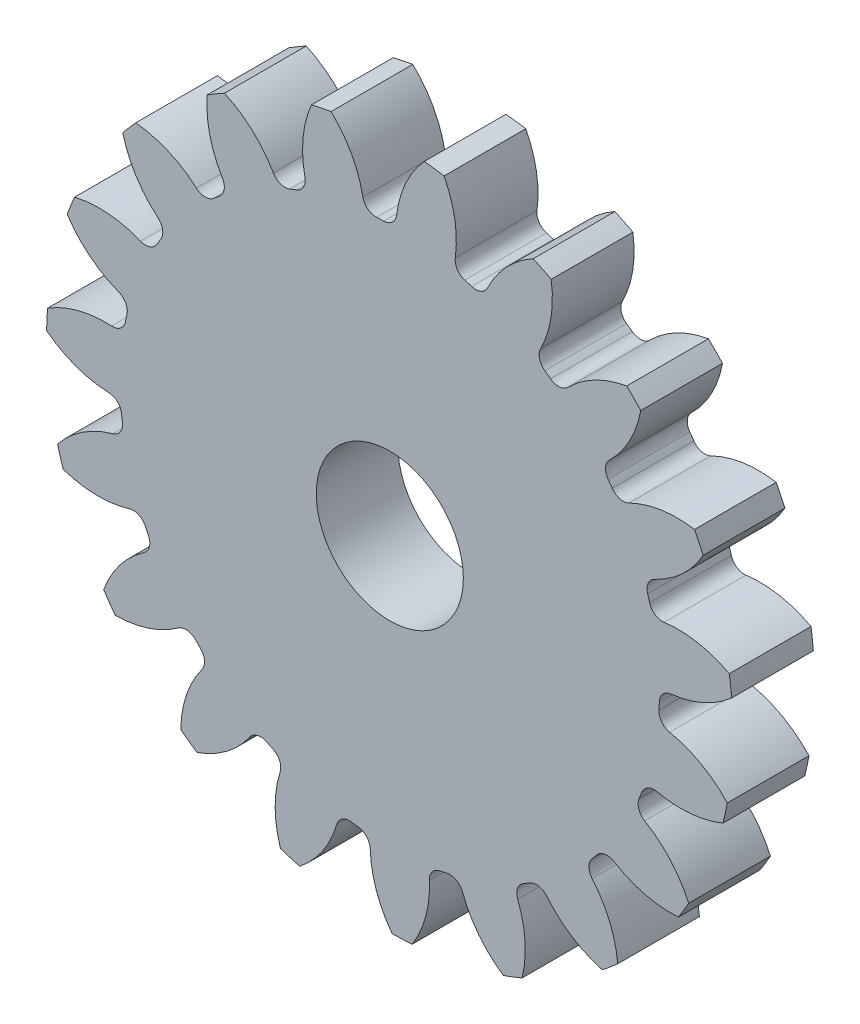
SolidWorks part; units mm, degrees
ref_plane "Front" through (0, 0, 0) normal (0, 0, 1) x (1, 0, 0)
ref_plane "Top" through (0, 0, 0) normal (0, 1, 0) x (1, 0, 0)
ref_plane "Right" through (0, 0, 0) normal (1, 0, 0) x (0, 0, -1)
sketch "Sketch3" plane through (0, 0, 0) normal (0, 0, 1) x (1, 0, 0)
  circle A0 centre (0, 0) radius 533.4
  dimension "od" = 1066.8
extrude "gearBody" add sketch "Sketch3" along normal blind 127
sketch "Sketch2" plane through (0, 0, 0) normal (0, 0, 1) x (1, 0, 0)
  line L0 (0, 0) -> (418.9754, 173.5453) construction
  line L1 (526.4137, -99.2395) -> (0, 0) construction
  line L2 (0, 0) -> (36.3143, 0) construction
  line L3 (482.2981, 17.0671) -> (478.5726, -62.2176) construction
  line L5 (480.4354, -22.5753) -> (0, 0) construction
  line L7 (0, 0) -> (453.4957, 0) construction
  arc A0 (453.4199, 8.2916) -> (450.6445, -50.7728) centre (0, 0) ccw construction
  arc A1 (531.2793, 47.5174) -> (524.4826, -97.1268) centre (0, 0) ccw construction
  arc A2 (482.2981, 17.0671) -> (478.5726, -62.2176) centre (0, 0) ccw construction
  arc A3 (418.3406, -25.2183) -> (418.862, -14.1211) centre (0, 0) ccw
  arc A4 (526.4137, -99.2395) -> (434.8188, -46.7152) centre (400.8557, -212.0684) ccw
  arc A5 (526.4137, -99.2395) -> (533.4, 49.4397) centre (0, 0) ccw
  arc A6 (533.4, 49.4397) -> (437.2835, 5.7358) centre (418.9754, 173.5453) cw
  arc A7 (418.862, -14.1211) -> (437.2835, 5.7358) centre (439.5259, -14.8178) cw
  arc A8 (434.8188, -46.7152) -> (418.3406, -25.2183) centre (438.9787, -26.4624) cw
  point P6 (533.4, 49.4397)
  point P22 (526.4137, -99.2395)
  dimension "baseDia" = 906.9913
  dimension "od" = 1066.8
  dimension "pd" = 965.2
  dimension "rd" = 838.2
  dimension "rFillet" = 20.6756
  dimension "pointX" = 533.4
  dimension "pointY" = 49.4397
  dimension "CTT" = 79.2847
  dimension "flankCenterAngle" = 22.5
extrude "toothCut" cut sketch "Sketch2" along normal through all
pattern_circular "CirPattern1" count 19 over 360 about axis through (0, 0, 0) along (0, 0, 1) of "toothCut"
sketch "hub1Dia" plane through (0, 0, 0) normal (0, 0, -1) x (-1, 0, 0)
  circle A0 centre (0, 0) radius 12.7
  dimension "hub1Dia" = 25.4
sketch "hub2Dia" plane through (0, 0, 127) normal (0, 0, 1) x (1, 0, 0)
  circle A0 centre (0, 0) radius 12.7
  dimension "hub2dia" = 25.4
sketch "boreDia" plane through (0, 0, 0) normal (0, 0, 1) x (1, 0, 0)
  circle A0 centre (0, 0) radius 114.3
  dimension "boreDia" = 228.6
extrude "bore" cut sketch "boreDia" against normal mid plane 25400
